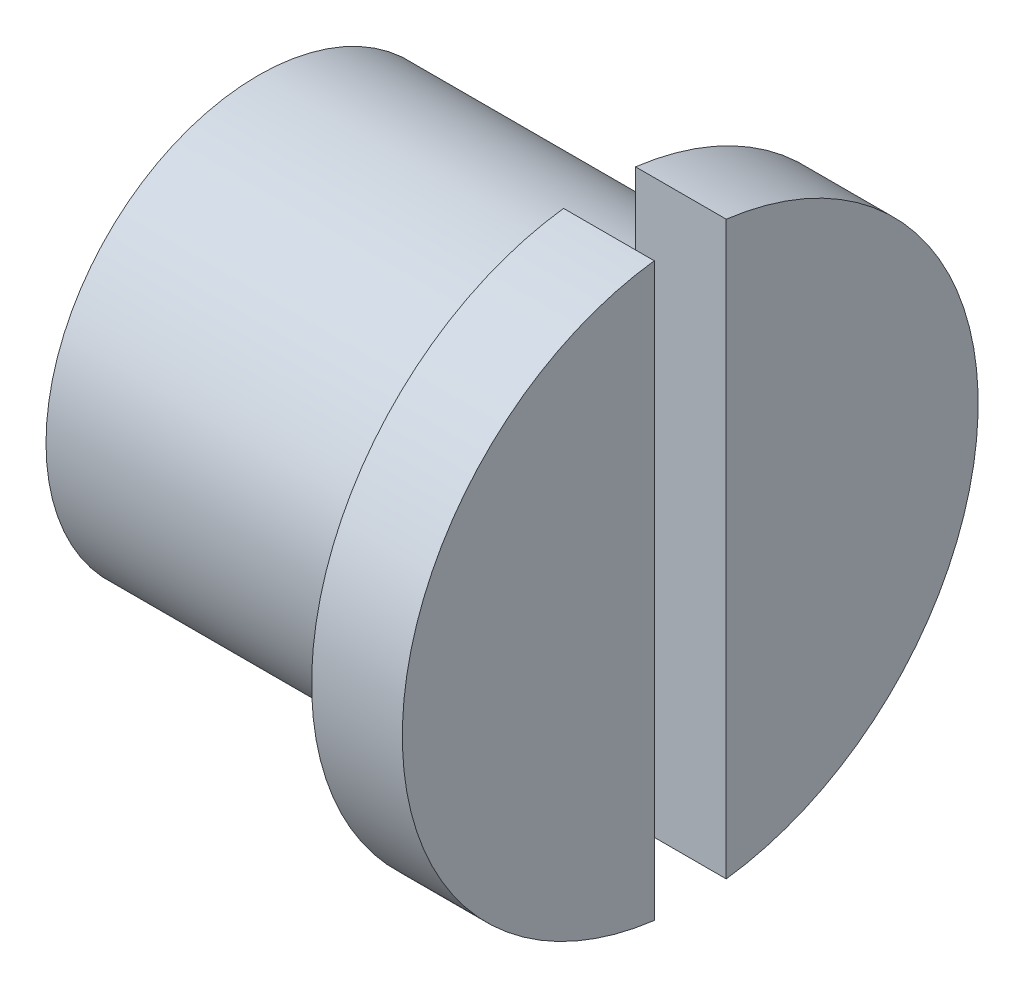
SolidWorks part; units mm, degrees
ref_plane "Front Plane" through (0, 0, 0) normal (0, 0, 1) x (1, 0, 0)
ref_plane "Top Plane" through (0, 0, 0) normal (0, 1, 0) x (1, 0, 0)
ref_plane "Right Plane" through (0, 0, 0) normal (1, 0, 0) x (0, 0, -1)
sketch "Sketch1" plane through (0, 0, 0) normal (0, 0, 1) x (1, 0, 0)
  line L0 (0, 0) -> (0, 3.7465)
  line L1 (0, 3.7465) -> (6.0198, 3.7465)
  line L2 (6.0198, 3.7465) -> (6.0198, 5.08)
  line L3 (6.0198, 5.08) -> (7.62, 5.08)
  line L4 (7.62, 5.08) -> (7.62, 0)
  line L5 (7.62, 0) -> (0, 0)
  dimension "D1" = 7.62
  dimension "D2" = 1.6002
  dimension "D3" = 3.7465
  dimension "D4" = 5.08
revolve "Revolve1" add sketch "Sketch1" angle 360 about L5
sketch "Sketch2" plane through (0, 0, 0) normal (1, 0, 0) x (0, 0, -1)
  line L0 (0, 0) -> (0, 5.08) construction
  line L2 (0.635, 5.2926) -> (-0.635, 5.2926)
  line L3 (0.635, 5.2926) -> (0.635, -5.3912)
  line L4 (0.635, -5.3912) -> (-0.635, -5.3912)
  line L5 (-0.635, 5.2926) -> (-0.635, -5.3912)
  circle A0 centre (0, 0) radius 5.08 construction
  dimension "D1" = 1.27
  dimension "D2" = 0.635
ref_plane "Plane1" through (7.62, 0, 0) normal (1, 0, 0) x (0, 0, -1)
sketch "Sketch3" plane through (7.62, 0, 0) normal (1, 0, 0) x (0, 0, -1)
  line L4 (0.635, 5.2926) -> (-0.635, 5.2926)
  line L5 (-0.635, 5.2926) -> (-0.635, -5.3912)
  line L6 (-0.635, -5.3912) -> (0.635, -5.3912)
  line L7 (0.635, -5.3912) -> (0.635, 5.2926)
  line L8 (0.635, 5.2926) -> (-0.635, 5.2926)
  line L9 (-0.635, 5.2926) -> (-0.635, -5.3912)
  line L10 (-0.635, -5.3912) -> (0.635, -5.3912)
  line L11 (0.635, -5.3912) -> (0.635, 5.2926)
  dimension "D1" = 0
extrude "Cut-Extrude1" cut sketch "Sketch3" against normal up to surface (1.6002 mm away)
